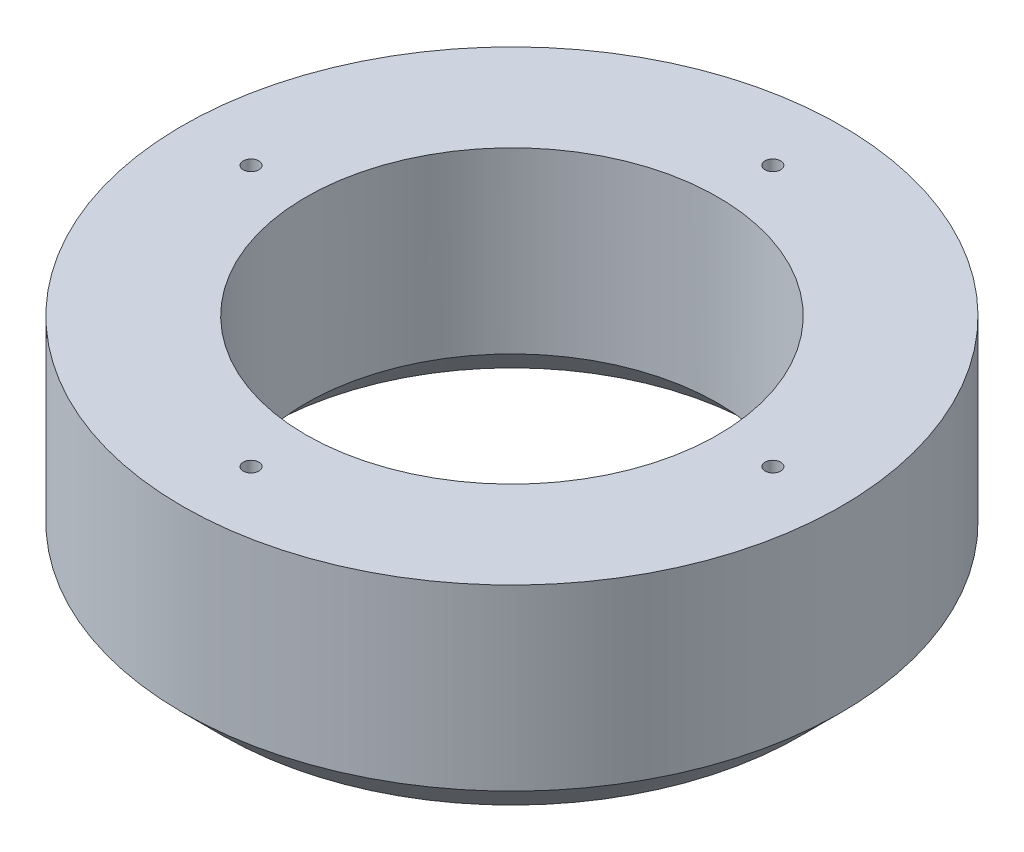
SolidWorks part; units mm, degrees
ref_plane "Front Plane" through (0, 0, 0) normal (0, 0, 1) x (1, 0, 0)
ref_plane "Top Plane" through (0, 0, 0) normal (0, 1, 0) x (1, 0, 0)
ref_plane "Right Plane" through (0, 0, 0) normal (1, 0, 0) x (0, 0, -1)
sketch "Sketch1" plane through (0, 0, 0) normal (0, 0, 1) x (1, 0, 0)
  line L0 (0, 0) -> (0, -473.5881) construction
  line L2 (381, 0) -> (609.6, 0)
  line L3 (381, 0) -> (381, -406.4)
  line L4 (381, -406.4) -> (609.6, -406.4)
  line L5 (609.6, 0) -> (609.6, -406.4)
  dimension "D1" = 381
  dimension "D2" = 609.6
  dimension "D3" = 406.4
revolve "Revolve1" add sketch "Sketch1" angle 360 about L0
chamfer "Chamfer1" distance 76.2 angle 45 1 edges at (0, -406.4, 609.6)
chamfer "Chamfer2" distance 76.2 angle 45 1 edges at (0, -406.4, 381)
sketch "Sketch2" plane through (0, 0, 0) normal (0, 1, 0) x (-1, 0, 0)
  circle A0 centre (-482.6, 0) radius 14.4145
  dimension "D1" = 482.6
extrude "Cut-Extrude1" cut sketch "Sketch2" against normal through all
pattern_circular "CirPattern1" count 4 over 360 about axis through (0, 0, 0) along (0, 1, 0) of "Cut-Extrude1"
